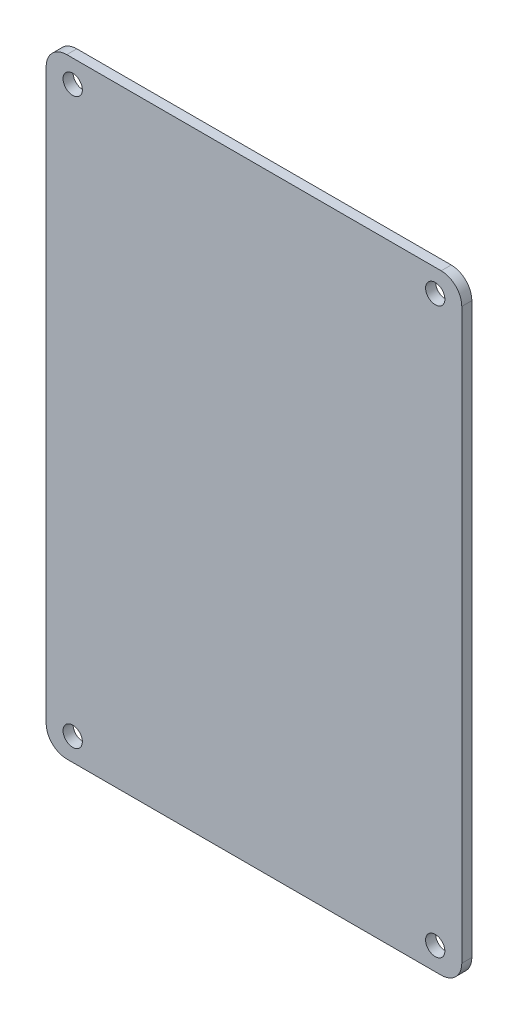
SolidWorks part; units mm, degrees
ref_plane "Front Plane" through (0, 0, 0) normal (0, 0, 1) x (1, 0, 0)
ref_plane "Top Plane" through (0, 0, 0) normal (0, 1, 0) x (1, 0, 0)
ref_plane "Right Plane" through (0, 0, 0) normal (1, 0, 0) x (0, 0, -1)
sketch "Sketch1" plane through (0, 0, 0) normal (0, 0, 1) x (1, 0, 0)
  line L1 (-32.0294, -47.0154) -> (32.0294, -47.0154)
  line L2 (-32.0294, -47.0154) -> (-32.0294, 47.0154)
  line L3 (-32.0294, 47.0154) -> (32.0294, 47.0154)
  line L4 (32.0294, -47.0154) -> (32.0294, 47.0154)
  line L5 (-32.0294, -47.0154) -> (32.0294, 47.0154) construction
  line L6 (-32.0294, 47.0154) -> (32.0294, -47.0154) construction
  line L7 (-27.94, -43.5102) -> (27.94, -43.5102) construction
  line L8 (-27.94, -43.5102) -> (-27.94, 43.5102) construction
  line L9 (-27.94, 43.5102) -> (27.94, 43.5102) construction
  line L10 (27.94, -43.5102) -> (27.94, 43.5102) construction
  line L11 (-27.94, -43.5102) -> (27.94, 43.5102) construction
  line L12 (-27.94, 43.5102) -> (27.94, -43.5102) construction
  circle A0 centre (27.94, 43.5102) radius 1.4859
  circle A1 centre (-27.94, 43.5102) radius 1.4859
  circle A2 centre (-27.94, -43.5102) radius 1.4859
  circle A3 centre (27.94, -43.5102) radius 1.4859
  point P0 (0, 0)
  point P6 (0, 0)
  dimension "D5" = 2.9718
  dimension "D1" = 64.0588
  dimension "D2" = 94.0308
  dimension "D3" = 55.88
  dimension "D4" = 87.0204
extrude "Boss-Extrude1" add sketch "Sketch1" along normal mid plane 1.5494
fillet "Fillet1" radius 3.175 4 edges at (-32.0294, -47.0154, 0) (32.0294, -47.0154, 0) (32.0294, 47.0154, 0) (-32.0294, 47.0154, 0)
